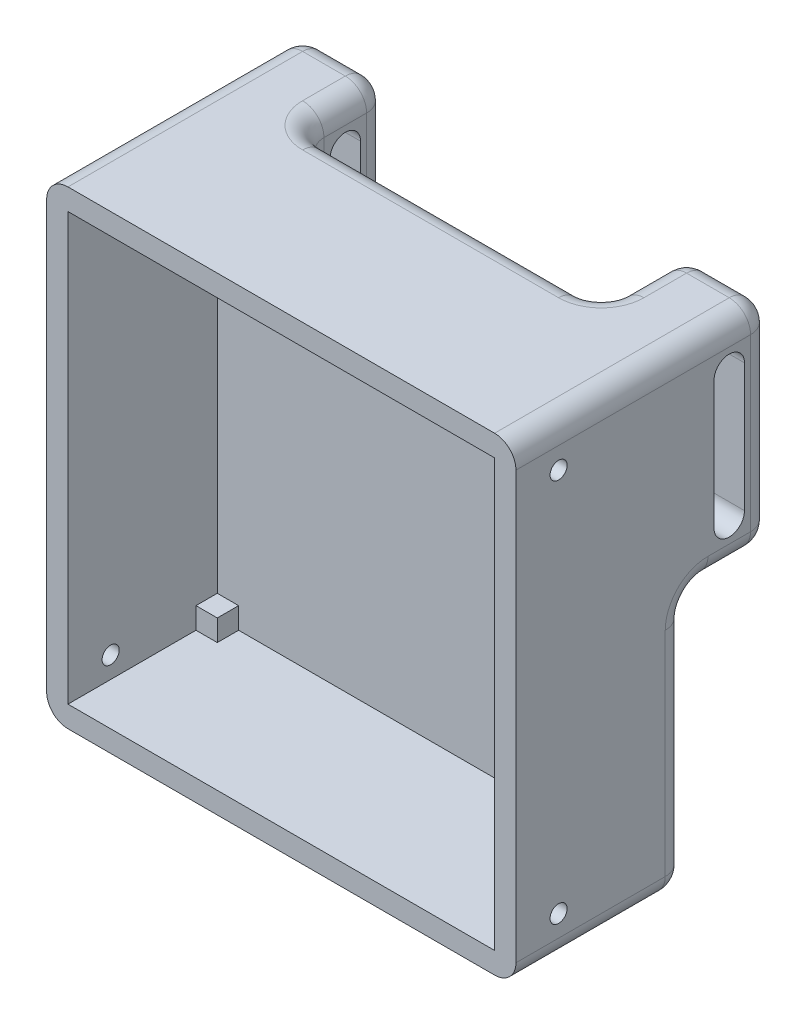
SolidWorks part; units mm, degrees
ref_plane "Front Plane" through (0, 0, 0) normal (0, 0, 1) x (1, 0, 0)
ref_plane "Top Plane" through (0, 0, 0) normal (0, 1, 0) x (1, 0, 0)
ref_plane "Right Plane" through (0, 0, 0) normal (1, 0, 0) x (0, 0, -1)
sketch "Sketch1" plane through (0, 0, 0) normal (0, 0, 1) x (1, 0, 0)
  line L1 (-55, -55) -> (55, -55)
  line L2 (-55, -55) -> (-55, 55)
  line L3 (-55, 55) -> (55, 55)
  line L4 (55, -55) -> (55, 55)
  line L5 (-55, -55) -> (55, 55) construction
  line L6 (-55, 55) -> (55, -55) construction
  point P0 (0, 0)
  dimension "D1" = 110
  dimension "D2" = 110
extrude "Boss-Extrude2" add sketch "Sketch1" along normal blind 40
sketch "Sketch3" plane through (0, 0, 40) normal (0, 0, 1) x (1, 0, 0)
  line L1 (-50, -50) -> (50, -50)
  line L2 (-50, -50) -> (-50, 50)
  line L3 (-50, 50) -> (50, 50)
  line L4 (50, -50) -> (50, 50)
  line L5 (-50, -50) -> (50, 50) construction
  line L6 (-50, 50) -> (50, -50) construction
  point P0 (0, 0)
  dimension "D1" = 100
  dimension "D2" = 100
extrude "Cut-Extrude1" cut sketch "Sketch3" against normal blind 35
sketch "Sketch4" plane through (0, 0, 0) normal (0, 0, -1) x (-1, 0, 0)
  line L1 (-55, 55) -> (-35, 55)
  line L2 (-55, 55) -> (-55, 5)
  line L3 (-55, 5) -> (-35, 5)
  line L4 (-35, 55) -> (-35, 5)
  line L5 (55, 55) -> (35, 55)
  line L6 (55, 55) -> (55, 5)
  line L7 (55, 5) -> (35, 5)
  line L8 (35, 55) -> (35, 5)
  dimension "D1" = 50
  dimension "D2" = 50
  dimension "D3" = 20
  dimension "D4" = 20
extrude "Boss-Extrude3" add sketch "Sketch4" along normal blind 20
fillet "Fillet1" radius 5 24 edges at (-55, 5, -10) (55, 5, -10) (35, 55, -10) (-35, 55, -10) (-55, -25, 0) (0, -55, 0) (55, -25, 0) (45, 5, 0) (35, 30, 0) (0, 55, 0) (-35, 30, 0) (-45, 5, 0) (-55, -55, 20) (55, -55, 20) (55, 55, 10) (-55, 55, 10) (-55, 30, -20) (-35, 30, -20) (35, 30, -20) (55, 30, -20) (45, 5, -20) (-45, 5, -20) (-45, 55, -20) (45, 55, -20)
sketch "Sketch5" plane through (-55, 0, 0) normal (-1, 0, 0) x (0, 0, 1)
  line L0 (-10, 45) -> (-10, 15) construction
  line L1 (-6.4267, 45) -> (-6.4267, 15)
  line L2 (-13.5733, 45) -> (-13.5733, 15)
  line L3 (-20, 10) -> (-20, 50) construction
  line L4 (-5, 5) -> (-15, 5) construction
  arc A0 (-6.4267, 45) -> (-13.5733, 45) centre (-10, 45) ccw
  arc A1 (-13.5733, 15) -> (-6.4267, 15) centre (-10, 15) ccw
  point P2 (-10, 30)
  dimension "D2" = 3.5733
  dimension "D1" = 10
  dimension "D3" = 25
  dimension "D4" = 15
extrude "Cut-Extrude2" cut sketch "Sketch5" against normal blind 150
fillet "Fillet2" radius 5 6 edges at (-36.4645, 6.4645, -18.5355) (-33.5355, 3.5355, -1.4645) (36.4645, 6.4645, -18.5355) (33.5355, 3.5355, -1.4645) (-35, 5, -10) (35, 5, -10)
sketch "Sketch6" plane through (-55, 0, 0) normal (-1, 0, 0) x (0, 0, 1)
  line L0 (40, -55) -> (5, -55) construction
  line L3 (40, 50) -> (40, -50) construction
  line L4 (-15, 55) -> (40, 55) construction
  circle A0 centre (30, 45) radius 2
  circle A1 centre (30, -45) radius 2
  dimension "D1" = 4
  dimension "D4" = 10
  dimension "D2" = 10
  dimension "D3" = 10
extrude "Cut-Extrude3" cut sketch "Sketch6" against normal through all
sketch "Sketch7" plane through (0, 0, 5) normal (0, 0, 1) x (1, 0, 0)
  line L0 (33, 0) -> (-33, 0) construction
  line L1 (-50, 50) -> (-45, 50)
  line L2 (-50, 50) -> (-50, 45)
  line L3 (-50, 45) -> (-45, 45)
  line L4 (-45, 50) -> (-45, 45)
  line L5 (-50, -45) -> (-45, -45)
  line L6 (-45, -50) -> (-45, -45)
  line L7 (-50, -50) -> (-45, -50)
  line L8 (-50, -50) -> (-50, -45)
  line L9 (0, -33) -> (0, 33) construction
  line L10 (50, 45) -> (45, 45)
  line L11 (45, 50) -> (45, 45)
  line L12 (50, 50) -> (45, 50)
  line L13 (50, 50) -> (50, 45)
  line L14 (50, -50) -> (50, -45)
  line L15 (50, -50) -> (45, -50)
  line L16 (45, -50) -> (45, -45)
  line L17 (50, -45) -> (45, -45)
  dimension "D1" = 5
  dimension "D2" = 5
extrude "Boss-Extrude4" add sketch "Sketch7" along normal blind 5
